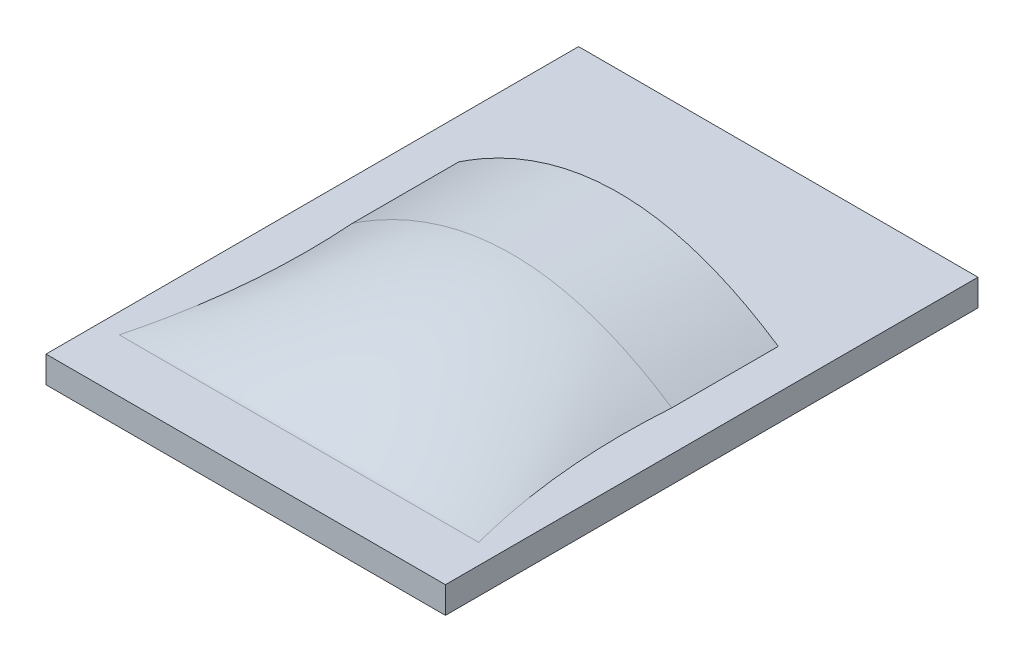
SolidWorks part; units mm, degrees
ref_plane "Ebene vorne" through (0, 0, 0) normal (0, 0, 1) x (1, 0, 0)
ref_plane "Ebene oben" through (0, 0, 0) normal (0, 1, 0) x (1, 0, 0)
ref_plane "Ebene rechts" through (0, 0, 0) normal (1, 0, 0) x (0, 0, -1)
sketch "Skizze1" plane through (0, 0, 0) normal (0, 0, 1) x (1, 0, 0)
  line L0 (0, 63.5132) -> (0, -39.9482) construction
  line L1 (-60, 0) -> (60, 0)
  spline S0 degree 2 poles (-60, 0) (0, 40) (60, 0) knots 0 0 0 1 1 1
  dimension "D1" = 60
  dimension "D2" = 20
sketch "Skizze2" plane through (0, 0, 0) normal (0, 1, 0) x (1, 0, 0)
  line L1 (-75, 100) -> (75, 100)
  line L2 (-75, 100) -> (-75, -100)
  line L3 (-75, -100) -> (75, -100)
  line L4 (75, 100) -> (75, -100)
  line L5 (-75, 100) -> (75, -100) construction
  line L6 (-75, -100) -> (75, 100) construction
  point P0 (0, 0)
  dimension "D1" = 200
  dimension "D2" = 150
extrude "Aufsatz-Linear austragen1" add sketch "Skizze2" against normal blind 10
sketch "Skizze3" plane through (0, 0, 0) normal (0, 1, 0) x (1, 0, 0)
  line L0 (-67.5, -80) -> (67.5, -80)
  dimension "D1" = 135
  dimension "D2" = 80
  dimension "D3" = 67.5
sketch "Skizze4" plane through (0, 0, 0) normal (0, 1, 0) x (1, 0, 0)
  line L0 (-60, 0) -> (60, 0) construction
  spline S0 degree 2 poles (-60, 0) (-57.123, -40.5485) (-67.5, -80) knots 0 0 0 1 1 1
  spline S1 degree 2 poles (60, 0) (57.123, -40.5485) (67.5, -80) knots 0 0 0 1 1 1
  dimension "D1" = 35
  dimension "D2" = 35
  dimension "D3" = 60
  dimension "D4" = 60
sketch "Skizze5" plane through (0, 0, 0) normal (0, 1, 0) x (1, 0, 0)
  line L0 (-60, 0) -> (60, 0) construction
  line L1 (-60, 0) -> (60, 0)
sketch "Skizze6" plane through (0, 0, 0) normal (0, 0, 1) x (1, 0, 0)
  line L0 (-60, 0) -> (60, 0) construction
  line L1 (-60, 0) -> (60, 0)
  parabola Q0 construction
  parabola Q1
extrude "Aufsatz-Linear austragen2" add sketch "Skizze6" against normal blind 40
sketch "Skizze9" plane through (0, 0, 0) normal (0, 0, 1) x (1, 0, 0)
  line L0 (-60, 0) -> (-60, -2)
  line L1 (-60, -2) -> (60, -2)
  line L2 (60, -2) -> (60, 0)
  parabola Q0 construction
  parabola Q1
  dimension "D1" = 2
ref_plane "Ebene1" through (0, 0, 80) normal (0, 0, 1) x (1, 0, 0)
sketch "Skizze10" plane through (0, 0, 80) normal (0, 0, 1) x (1, 0, 0)
  line L0 (-67.5, 0) -> (67.5, 0) construction
  line L1 (-67.5, 0) -> (67.5, 0)
  line L2 (-67.5, 0) -> (-67.5, -2)
  line L3 (-67.5, -2) -> (67.5, -2)
  line L4 (67.5, -2) -> (67.5, 0)
  dimension "D1" = 2
loft "Ausformung2" add profiles "Skizze9", "Skizze10"
